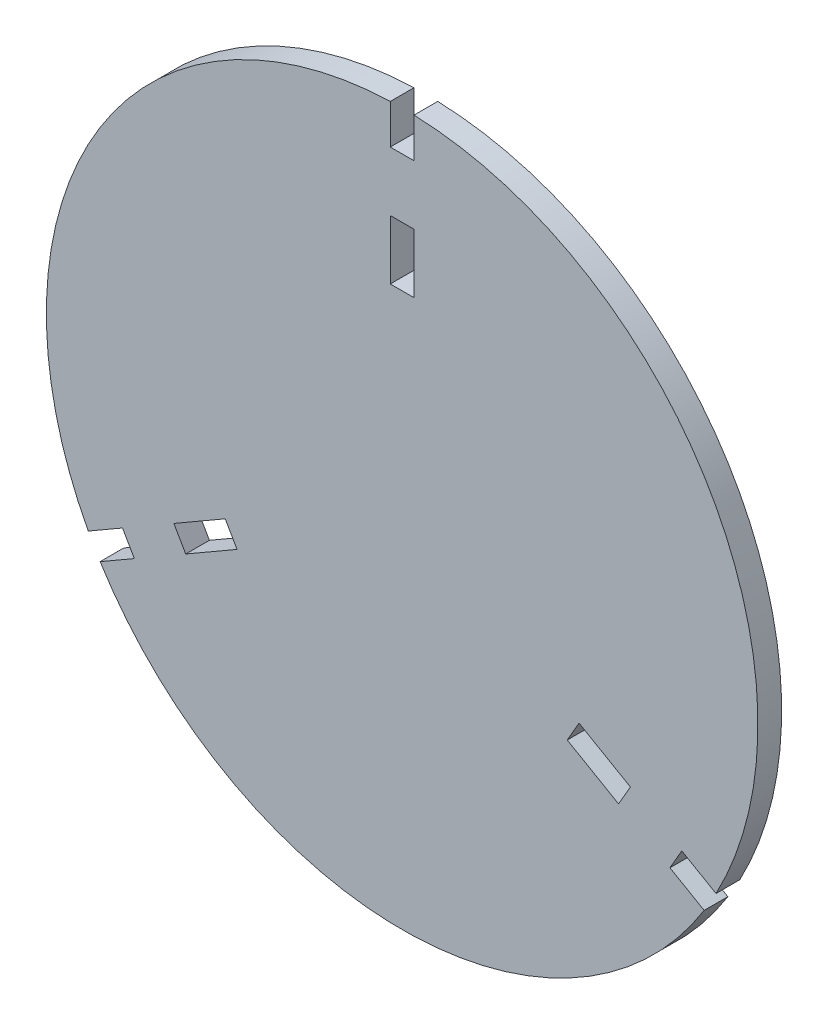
SolidWorks part; units mm, degrees
ref_plane "Alzado" through (0, 0, 0) normal (0, 0, 1) x (1, 0, 0)
ref_plane "Planta" through (0, 0, 0) normal (0, 1, 0) x (1, 0, 0)
ref_plane "Vista lateral" through (0, 0, 0) normal (1, 0, 0) x (0, 0, -1)
sketch "Sketch1" plane through (0, 0, 0) normal (0, 0, 1) x (1, 0, 0)
  line L0 (152.7979, -95.1461) -> (135.4774, -85.1461)
  line L2 (-6, 179.9) -> (-6, 159.9)
  line L3 (-6, 159.9) -> (6, 159.9)
  line L4 (6, 179.9) -> (6, 159.9)
  line L5 (-6, 179.9) -> (6, 159.9) construction
  line L6 (-6, 159.9) -> (6, 179.9) construction
  line L7 (-6, 129.9) -> (6, 129.9)
  line L8 (-6, 129.9) -> (-6, 99.9)
  line L9 (-6, 99.9) -> (6, 99.9)
  line L10 (6, 129.9) -> (6, 99.9)
  line L11 (-6, 129.9) -> (6, 99.9) construction
  line L12 (-6, 99.9) -> (6, 129.9) construction
  line L13 (141.4774, -74.7538) -> (135.4774, -85.1461)
  line L14 (158.7979, -84.7538) -> (141.4774, -74.7538)
  line L15 (115.4967, -59.7538) -> (109.4967, -70.1461)
  line L16 (115.4967, -59.7538) -> (89.5159, -44.7538)
  line L17 (109.4967, -70.1461) -> (83.5159, -55.1461)
  line L18 (89.5159, -44.7538) -> (83.5159, -55.1461)
  line L19 (-158.7979, -84.7538) -> (-141.4774, -74.7538)
  line L20 (-135.4774, -85.1461) -> (-141.4774, -74.7538)
  line L21 (-152.7979, -95.1461) -> (-135.4774, -85.1461)
  line L22 (-109.4967, -70.1461) -> (-115.4967, -59.7538)
  line L23 (-109.4967, -70.1461) -> (-83.5159, -55.1461)
  line L24 (-115.4967, -59.7538) -> (-89.5159, -44.7538)
  line L25 (-83.5159, -55.1461) -> (-89.5159, -44.7538)
  arc A0 (-6, 179.9) -> (-158.7979, -84.7538) centre (0, 0) ccw
  arc A1 (-152.7979, -95.1461) -> (152.7979, -95.1461) centre (0, 0) ccw
  arc A2 (158.7979, -84.7538) -> (6, 179.9) centre (0, 0) ccw
  point P7 (0, 169.9)
  point P14 (0, 114.9)
  point P31 (0, 0)
  dimension "D1" = 360
  dimension "D2" = 20
  dimension "D3" = 12
  dimension "D4" = 30
  dimension "D5" = 30
  dimension "D6" = 12
  dimension "D7" = 3
extrude "Boss-Extrude1" add sketch "Sketch1" along normal blind 12
